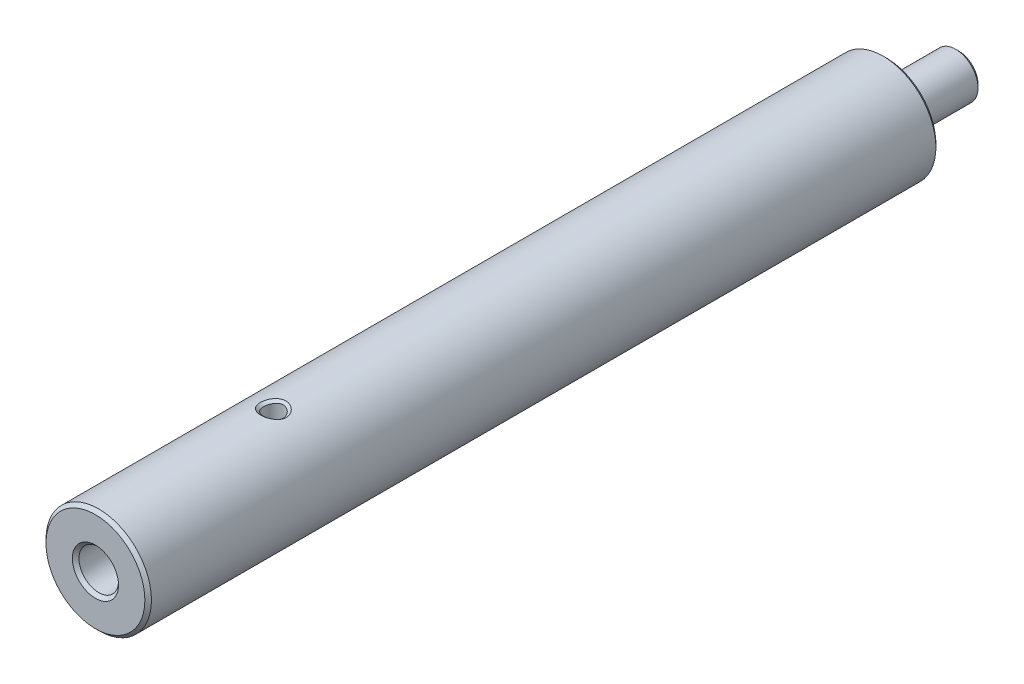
SolidWorks part; units mm, degrees
ref_plane "Спереди" through (0, 0, 0) normal (0, 0, 1) x (1, 0, 0)
ref_plane "Сверху" through (0, 0, 0) normal (0, 1, 0) x (1, 0, 0)
ref_plane "Справа" through (0, 0, 0) normal (1, 0, 0) x (0, 0, -1)
sketch "Эскиз1" plane through (0, 0, 0) normal (1, 0, 0) x (0, 0, -1)
  line L0 (0, 0) -> (0, 1.5)
  line L1 (0, 1.5) -> (-15, 1.5)
  line L2 (-15, 1.5) -> (-15, 4)
  line L3 (-15, 4) -> (45, 4)
  line L4 (45, 4) -> (45, 1.7)
  line L5 (45, 1.7) -> (50.5, 1.7)
  line L6 (50.5, 1.7) -> (50.5, 0)
  line L7 (50.5, 0) -> (0, 0)
  dimension "D1" = 15
  dimension "D2" = 1.5
  dimension "D3" = 4
  dimension "D4" = 5.5
  dimension "D5" = 60
  dimension "D6" = 1.7
revolve "Повернуть1" add sketch "Эскиз1" angle 360 about L7
sketch "Эскиз2" plane through (0, 0, 0) normal (0, 1, 0) x (1, 0, 0)
  line L1 (-4, -15) -> (4, -15) construction
  circle A0 centre (0, -1.5) radius 0.75
  dimension "D1" = 1.5
  dimension "D2" = 13.5
extrude "Вырез-Вытянуть1" cut sketch "Эскиз2" against normal mid plane 10
chamfer "Фаска1" distance 0.25 angle 45 9 edges at (-4, 0, -45) (-4, 0, 15) (0.1578, -3.9969, 0.7668) (-0.1578, 3.9969, 0.7668) (-1.5, 0, 15) (-1.5, 0, 0) (-1.7, 0, -50.5) (-0.0757, -1.4981, 0.7538) (0.0757, 1.4981, 0.7538)
